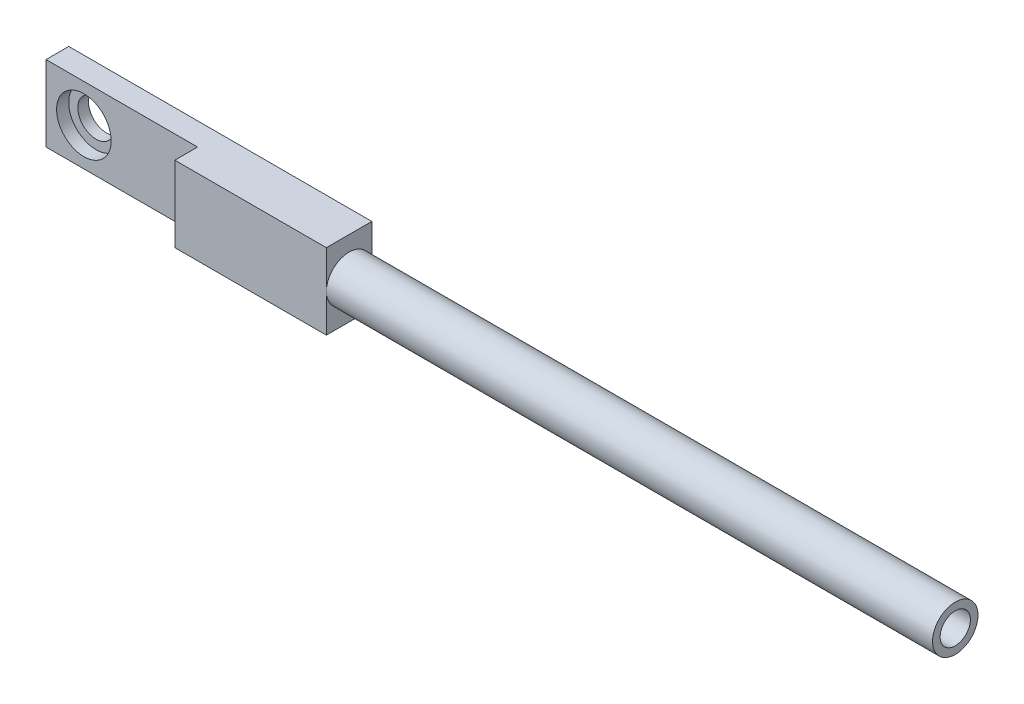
SolidWorks part; units mm, degrees
ref_plane "Front Plane" through (0, 0, 0) normal (0, 0, 1) x (1, 0, 0)
ref_plane "Top Plane" through (0, 0, 0) normal (0, 1, 0) x (1, 0, 0)
ref_plane "Right Plane" through (0, 0, 0) normal (1, 0, 0) x (0, 0, -1)
sketch "Sketch1" plane through (0, 0, 0) normal (0, 0, 1) x (1, 0, 0)
  line L1 (0, 0) -> (100, 0)
  line L2 (0, 0) -> (0, 25)
  line L3 (0, 25) -> (100, 25)
  line L4 (100, 0) -> (100, 25)
extrude "Boss-Extrude1" add sketch "Sketch1" along normal blind 15
sketch "Sketch2" plane through (100, 0, 0) normal (1, 0, 0) x (0, 0, -1)
  circle A0 centre (-7.5, 12.5) radius 7.5
extrude "Boss-Extrude2" add sketch "Sketch2" along normal blind 200
sketch "Sketch3" plane through (0, 0, 15) normal (0, 0, 1) x (1, 0, 0)
  line L0 (0, 0) -> (100, 0) construction
  line L1 (0, 25) -> (50, 25)
  line L2 (0, 25) -> (0, 0)
  line L3 (0, 0) -> (50, 0)
  line L4 (50, 25) -> (50, 0)
extrude "Cut-Extrude1" cut sketch "Sketch3" against normal blind 7.5
sketch "Sketch4" plane through (300, 0, 0) normal (1, 0, 0) x (0, 0, -1)
  circle A0 centre (-7.5, 12.5) radius 5
extrude "Cut-Extrude4" cut sketch "Sketch4" against normal blind 200
sketch "Sketch9" plane through (0, 0, 7.5) normal (0, 0, 1) x (1, 0, 0)
  circle A0 centre (12.5, 12.5) radius 6
extrude "Cut-Extrude5" cut sketch "Sketch9" against normal blind 10
sketch "Sketch10" plane through (0, 0, 7.5) normal (0, 0, 1) x (1, 0, 0)
  circle A0 centre (12.5, 12.5) radius 9
extrude "Cut-Extrude6" cut sketch "Sketch10" against normal blind 4
